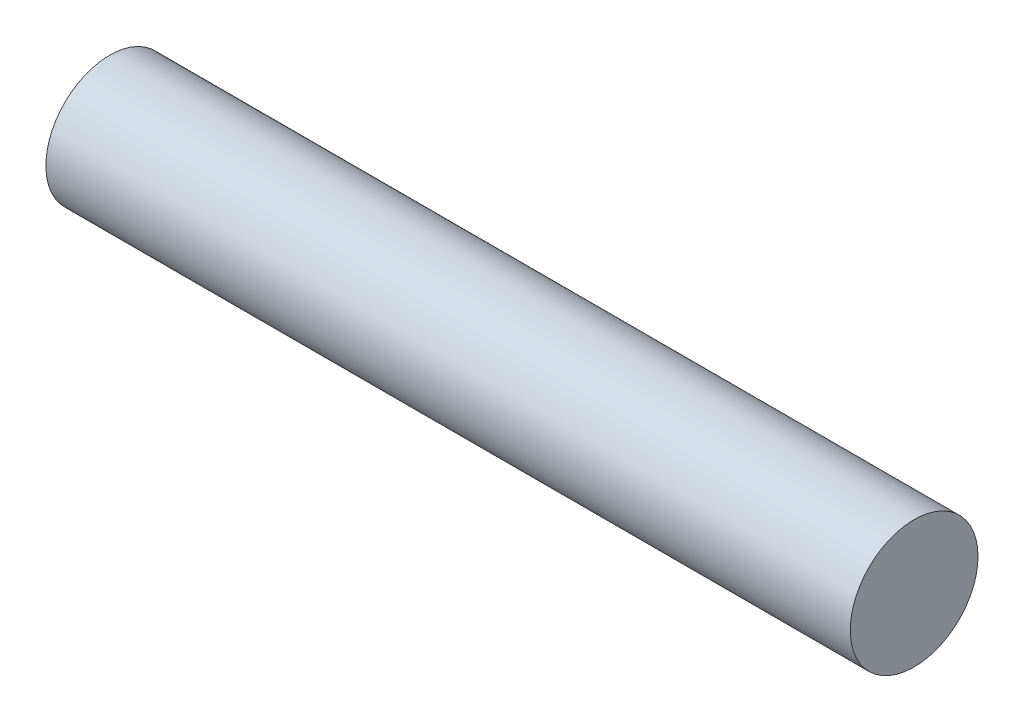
SolidWorks part; units mm, degrees
ref_plane "Front Plane" through (0, 0, 0) normal (0, 0, 1) x (1, 0, 0)
ref_plane "Top Plane" through (0, 0, 0) normal (0, 1, 0) x (1, 0, 0)
ref_plane "Right Plane" through (0, 0, 0) normal (1, 0, 0) x (0, 0, -1)
sketch "Sketch1" plane through (0, 0, 0) normal (1, 0, 0) x (0, 0, -1)
  circle A0 centre (0, 0) radius 4.7625
  dimension "D1" = 9.525
extrude "Boss-Extrude1" add sketch "Sketch1" along normal blind 60
